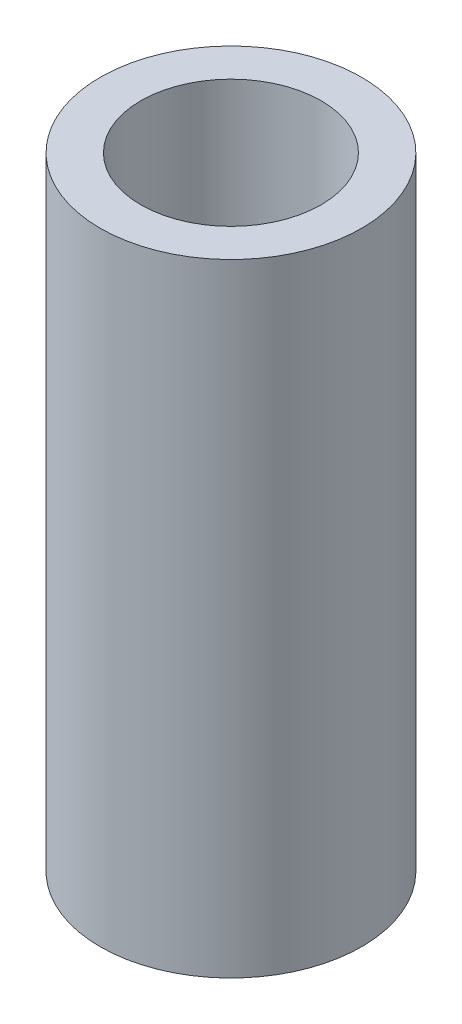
SolidWorks part; units mm, degrees
ref_plane "Aufriss" through (0, 0, 0) normal (0, 0, 1) x (1, 0, 0)
ref_plane "Grundriss" through (0, 0, 0) normal (0, 1, 0) x (1, 0, 0)
ref_plane "Seitenriss" through (0, 0, 0) normal (1, 0, 0) x (0, 0, -1)
sketch "Skizze1" plane through (0, 0, 0) normal (0, 1, 0) x (1, 0, 0)
  circle A0 centre (0, 0) radius 7.25
  circle A1 centre (0, 0) radius 5
  dimension "D1" = 14.5
  dimension "D2" = 10
extrude "Aufsatz-Linear austragen1" add sketch "Skizze1" along normal mid plane 34.5
